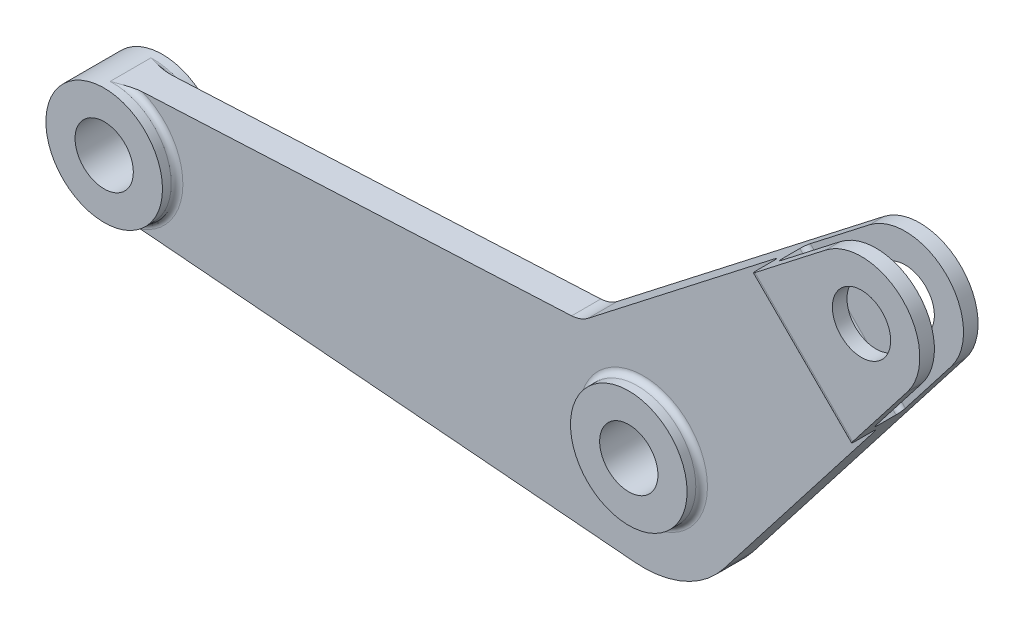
SolidWorks part; units mm, degrees
ref_plane "正面" through (0, 0, 0) normal (0, 0, 1) x (1, 0, 0)
ref_plane "平面" through (0, 0, 0) normal (0, 1, 0) x (1, 0, 0)
ref_plane "右側面" through (0, 0, 0) normal (1, 0, 0) x (0, 0, -1)
sketch "ｽｹｯﾁ1" plane through (0, 0, 0) normal (0, 0, 1) x (1, 0, 0)
  line L0 (0, 0) -> (84.8528, 84.8528) construction
  line L1 (0, 0) -> (-180, 0) construction
  circle A0 centre (0, 0) radius 35
  circle A1 centre (-180, 0) radius 20
  circle A2 centre (84.8528, 84.8528) radius 20
  circle A3 centre (0, 0) radius 20
  dimension "D1" = 40
  dimension "D5" = 70
  dimension "D2" = 180
  dimension "D3" = 135
  dimension "D4" = 120
sketch "ｽｹｯﾁ2" plane through (0, 0, 0) normal (0, 0, 1) x (1, 0, 0)
  line L0 (-21.461, 27.6482) -> (72.5894, 100.6518)
  line L1 (-21.461, 27.6482) -> (-180.9608, 19.9769)
  line L2 (-181.6667, -19.9304) -> (-2.9167, -34.8783)
  line L3 (27.6482, -21.461) -> (100.6518, 72.5894)
  circle A0 centre (0, 0) radius 35 construction
  circle A1 centre (84.8528, 84.8528) radius 20 construction
  circle A2 centre (-180, 0) radius 20 construction
  arc A3 (100.6518, 72.5894) -> (72.5894, 100.6518) centre (84.8528, 84.8528) ccw
  arc A4 (-180.9608, 19.9769) -> (-181.6667, -19.9304) centre (-180, 0) ccw
  arc A5 (-2.9167, -34.8783) -> (27.6482, -21.461) centre (0, 0) ccw
extrude "ﾎﾞｽ - 押し出し1" add sketch "ｽｹｯﾁ2" along normal mid plane 10
sketch "ｽｹｯﾁ3" plane through (0, 0, 0) normal (0, 0, 1) x (1, 0, 0)
  circle A0 centre (-180, 0) radius 20 construction
  circle A1 centre (-180, 0) radius 20
extrude "ﾎﾞｽ - 押し出し2" add sketch "ｽｹｯﾁ3" along normal mid plane 20
sketch "ｽｹｯﾁ4" plane through (0, 0, 0) normal (0, 0, 1) x (1, 0, 0)
  circle A0 centre (0, 0) radius 20 construction
  circle A1 centre (0, 0) radius 20
extrude "ﾎﾞｽ - 押し出し3" add sketch "ｽｹｯﾁ4" along normal mid plane 20
sketch "ｽｹｯﾁ5" plane through (0, 0, -5) normal (0, 0, 1) x (1, 0, 0)
  line L0 (72.5894, 100.6518) -> (-21.461, 27.6482) construction
  line L1 (27.6482, -21.461) -> (100.6518, 72.5894) construction
  line L2 (72.5894, 100.6518) -> (46.7131, 80.5662)
  line L3 (80.5662, 46.7131) -> (100.6518, 72.5894)
  line L5 (46.7131, 80.5662) -> (80.5662, 46.7131)
  line L6 (27.6482, -21.461) -> (100.6518, 72.5894) construction
  line L7 (0, 0) -> (84.8528, 84.8528) construction
  line L8 (63.6396, 63.6396) -> (84.8528, 84.8528) construction
  arc A0 (100.6518, 72.5894) -> (72.5894, 100.6518) centre (84.8528, 84.8528) ccw construction
  arc A1 (100.6518, 72.5894) -> (72.5894, 100.6518) centre (84.8528, 84.8528) ccw
  dimension "D1" = 30
extrude "ﾎﾞｽ - 押し出し4" add sketch "ｽｹｯﾁ5" along normal blind 20
ref_plane "平面1" through (0, 0, 0) normal (-0.7071, 0.7071, 0) x (0.7071, 0.7071, 0)
sketch "ｽｹｯﾁ6" plane through (0, 0, 0) normal (-0.7071, 0.7071, 0) x (0.7071, 0.7071, 0)
  line L0 (140, -15) -> (140, 5) construction
  line L1 (140, 0) -> (95, 0)
  line L2 (140, 0) -> (140, -10)
  line L3 (140, -10) -> (95, -10)
  line L4 (95, 0) -> (95, -10)
  line L5 (140, 5) -> (122.5, 5) construction
  line L6 (90, -15) -> (90, -5) construction
  dimension "D1" = 5
  dimension "D2" = 10
  dimension "D3" = 5
extrude "ｶｯﾄ - 押し出し1" cut sketch "ｽｹｯﾁ6" against normal through all both and the other way through all
sketch "ｽｹｯﾁ7" plane through (0, 0, 0) normal (0, 0, 1) x (1, 0, 0)
  circle A0 centre (84.8528, 84.8528) radius 10
  circle A1 centre (0, 0) radius 10
  circle A2 centre (-180, 0) radius 10
  dimension "D1" = 20
extrude "ｶｯﾄ - 押し出し2" cut sketch "ｽｹｯﾁ7" against normal through all both and the other way through all
fillet "ﾌｨﾚｯﾄ1" radius 2 8 edges at (20, 0, -5) (67.1751, 67.1751, 10) (67.1751, 67.1751, 0) (63.6396, 63.6396, 5) (63.6396, 63.6396, 15) (20, 0, 5) (-160.0031, -0.3537, -5) (-160.0031, -0.3537, 5)
fillet "ﾌｨﾚｯﾄ2" radius 10 1 edges at (-21.461, 27.6482, 0)
